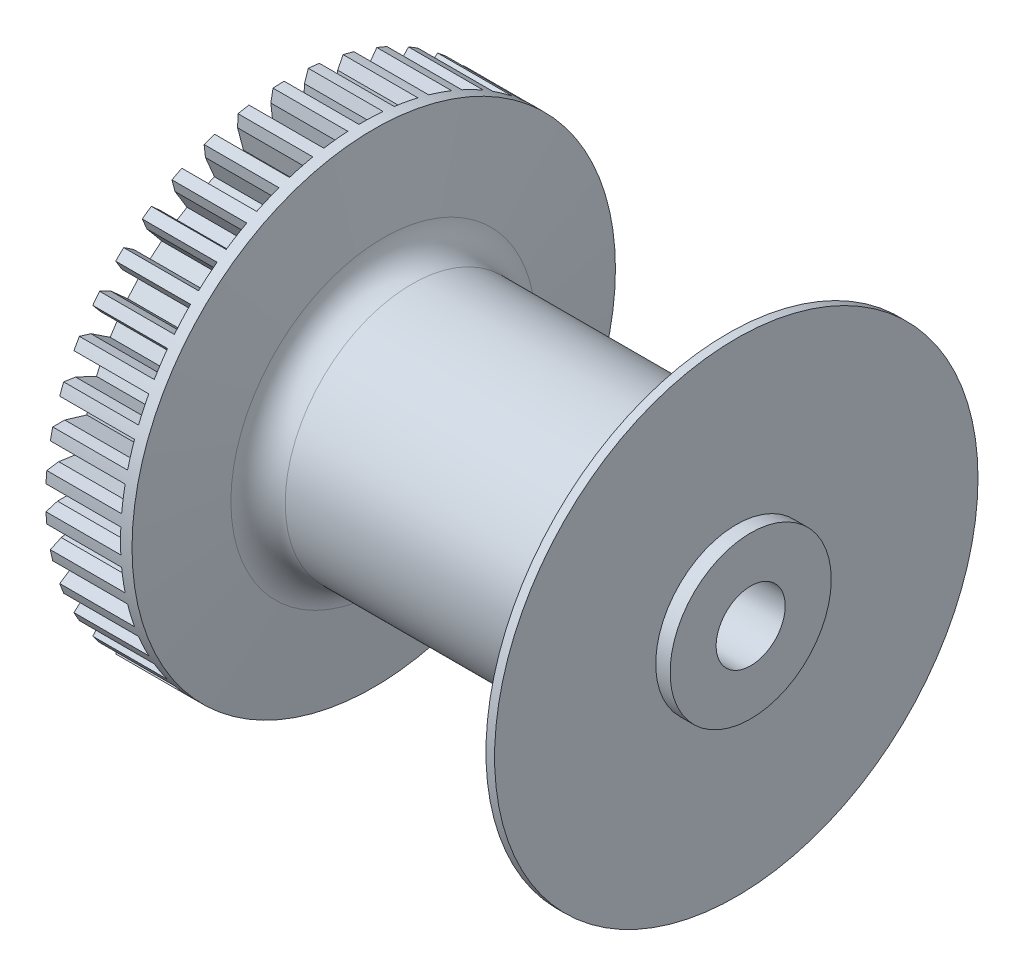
SolidWorks part; units mm, degrees
ref_plane "Plan de face" through (0, 0, 0) normal (0, 0, 1) x (1, 0, 0)
ref_plane "Plan de dessus" through (0, 0, 0) normal (0, 1, 0) x (1, 0, 0)
ref_plane "Plan de droite" through (0, 0, 0) normal (1, 0, 0) x (0, 0, -1)
sketch "Esquisse1" plane through (0, 0, 0) normal (0, 0, 1) x (1, 0, 0)
  line L0 (-41, 42) -> (-41, 0)
  line L1 (-41, 0) -> (37, 0)
  line L2 (37, 0) -> (37, 42)
  line L3 (37, 42) -> (35.5, 42)
  line L4 (35.5, 42) -> (32.2539, 22)
  line L5 (32.2539, 22) -> (-23.8732, 22)
  line L6 (-23.8732, 22) -> (-26, 42)
  line L7 (-26, 42) -> (-41, 42)
  line L8 (-41, 0) -> (37, 0) construction
revolve "Révolution1" add sketch "Esquisse1" angle 360 about L8
sketch "Esquisse2" plane through (-41, 0, 0) normal (-1, 0, 0) x (0, 0, 1)
  line L0 (39.9475, 1.5) -> (35.9475, 1.5)
  line L1 (35.9475, 1.5) -> (35.9475, -1.5)
  line L2 (35.9475, -1.5) -> (39.9475, -1.5)
  line L3 (39.9475, -1.5) -> (41.9475, -2.1)
  line L4 (39.9475, 1.5) -> (41.9475, 2.1)
  line L5 (35.9475, 0) -> (0, 0) construction
  arc A0 (41.9475, -2.1) -> (41.9475, 2.1) centre (0, 0) ccw
  circle A1 centre (0, 0) radius 42 construction
  dimension "D1" = 3
  dimension "D2" = 4
  dimension "D3" = 2
  dimension "D4" = 0.6
  dimension "D5" = 4
  dimension "D6" = 2
  dimension "D7" = 0.6
extrude "Enlèv. mat.-Extru.1" cut sketch "Esquisse2" against normal blind 13
pattern_circular "Répétition circulaire1" count 43 over 360 about axis through (0, 0, 0) along (1, 0, 0) of "Enlèv. mat.-Extru.1"
sketch "Esquisse44" plane through (37, 0, 0) normal (1, 0, 0) x (0, 0, -1)
  circle A0 centre (0, 0) radius 14
extrude "Boss.-Extru.1" add sketch "Esquisse44" along normal blind 2.5
hole_wizard "Diamètre du perçage Ø12.0 (12)1" positions "Esquisse46" profile "Esquisse45" hole size "Ø12.0" standard "Ansi Metric"
sketch "Esquisse46" plane through (39.5, 0, 0) normal (1, 0, 0) x (0, 0, -1)
  point P0 (0, 0)
sketch "Esquisse45" plane through (39.5, 0, 0) normal (0, 1, 0) x (0, 0, -1)
  line L0 (0, 0) -> (0, 80.5)
  line L1 (0, 80.5) -> (6, 80.5)
  line L2 (6, 80.5) -> (6, 0)
  line L5 (6, 0) -> (0, 0)
  line L11 (0, -6.35) -> (0, 107.95) construction
  dimension "Diamètre du perçage jusqu'au prochain" = 12
  dimension "Profondeur du perçage jusqu'au prochain" = 80.5
fillet "Congé1" radius 5 2 edges at (32.2539, 0, -22) (-23.8732, 0, -22)
